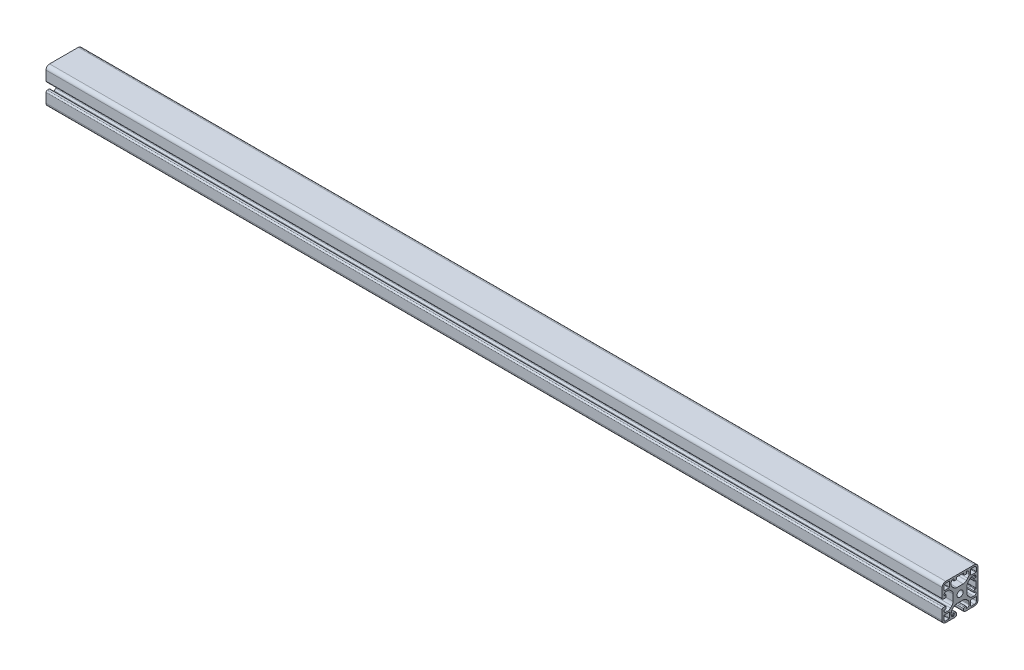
SolidWorks part; units mm, degrees
ref_plane "Ebene vorne" through (0, 0, 0) normal (0, 0, 1) x (1, 0, 0)
ref_plane "Ebene oben" through (0, 0, 0) normal (0, 1, 0) x (1, 0, 0)
ref_plane "Ebene rechts" through (0, 0, 0) normal (1, 0, 0) x (0, 0, -1)
sketch "Skizze1" plane through (0, 0, 0) normal (0, 1, 0) x (1, 0, 0)
  line L0 (0, 0) -> (1000, 0)
  dimension "D1" = 1000
other "Strukturbauteil1"
ref_plane "Ebene1" through (0, 0, 0) normal (1, 0, 0) x (0, 0, -1)
sketch "Model" plane through (0, 0, 0) normal (1, 0, 0) x (0, 0, -1)
  line L0 (-5, 15.5) -> (-6.5, 15.5)
  line L1 (-7, 16) -> (-7, 17.5)
  line L2 (-10, 15.5) -> (-10, 14.1924)
  line L3 (-8.5355, 10.6569) -> (-7.0931, 9.2145)
  line L4 (-3.5576, 7.75) -> (3.5576, 7.75)
  line L5 (7.0931, 9.2145) -> (8.5355, 10.6569)
  line L6 (10, 14.1924) -> (10, 15.5)
  line L7 (7, 17.5) -> (7, 16)
  line L8 (6.5, 15.5) -> (5, 15.5)
  line L9 (4, 16.5) -> (4, 17.5)
  line L10 (3.5, 18) -> (-3.5, 18)
  line L11 (-4, 17.5) -> (-4, 16.5)
  line L12 (11.8, 17.7) -> (11.8, 12.3)
  line L13 (12.3, 11.8) -> (17.7, 11.8)
  line L14 (18.2, 12.3) -> (18.2, 16)
  line L15 (16, 18.2) -> (12.3, 18.2)
  line L16 (-16, 18.2) -> (-12.3, 18.2)
  line L17 (-11.8, 17.7) -> (-11.8, 12.3)
  line L18 (-12.3, 11.8) -> (-17.7, 11.8)
  line L19 (-18.2, 12.3) -> (-18.2, 16)
  line L20 (-16, -18.2) -> (-12.3, -18.2)
  line L21 (-11.8, -17.7) -> (-11.8, -12.3)
  line L22 (-12.3, -11.8) -> (-17.7, -11.8)
  line L23 (-18.2, -12.3) -> (-18.2, -16)
  line L24 (12.3, -18.2) -> (16, -18.2)
  line L25 (18.2, -16) -> (18.2, -12.3)
  line L26 (17.7, -11.8) -> (12.3, -11.8)
  line L27 (11.8, -12.3) -> (11.8, -17.7)
  line L28 (15.5, 5) -> (15.5, 6.5)
  line L29 (16, 7) -> (17.5, 7)
  line L30 (15.5, 10) -> (14.1924, 10)
  line L31 (10.6569, 8.5355) -> (9.2145, 7.0931)
  line L32 (7.75, 3.5576) -> (7.75, -3.5576)
  line L33 (9.2145, -7.0931) -> (10.6569, -8.5355)
  line L34 (14.1924, -10) -> (15.5, -10)
  line L35 (17.5, -7) -> (16, -7)
  line L36 (15.5, -6.5) -> (15.5, -5)
  line L37 (16.5, -4) -> (17.5, -4)
  line L38 (18, -3.5) -> (18, 3.5)
  line L39 (17.5, 4) -> (16.5, 4)
  line L40 (-20, -5.5) -> (-20, -16)
  line L41 (-16, -20) -> (-5.5, -20)
  line L42 (-4, -18.5) -> (-4, -16.5)
  line L43 (-5, -15.5) -> (-6.5, -15.5)
  line L44 (-7, -16) -> (-7, -17.5)
  line L45 (-10, -15.5) -> (-10, -14.1924)
  line L46 (-8.5355, -10.6569) -> (-7.0931, -9.2145)
  line L47 (-3.5576, -7.75) -> (3.5576, -7.75)
  line L48 (7.0931, -9.2145) -> (8.5355, -10.6569)
  line L49 (10, -14.1924) -> (10, -15.5)
  line L50 (7, -17.5) -> (7, -16)
  line L51 (6.5, -15.5) -> (5, -15.5)
  line L52 (4, -16.5) -> (4, -18.5)
  line L53 (5.5, -20) -> (16, -20)
  line L54 (20, -16) -> (20, 16)
  line L55 (16, 20) -> (-16, 20)
  line L56 (-20, 16) -> (-20, 5.5)
  line L57 (-18.5, 4) -> (-16.5, 4)
  line L58 (-15.5, 5) -> (-15.5, 6.5)
  line L59 (-16, 7) -> (-17.5, 7)
  line L60 (-15.5, 10) -> (-14.1924, 10)
  line L61 (-10.6569, 8.5355) -> (-9.2145, 7.0931)
  line L62 (-7.75, 3.5576) -> (-7.75, -3.5576)
  line L63 (-9.2145, -7.0931) -> (-10.6569, -8.5355)
  line L64 (-14.1924, -10) -> (-15.5, -10)
  line L65 (-17.5, -7) -> (-16, -7)
  line L66 (-15.5, -6.5) -> (-15.5, -5)
  line L67 (-16.5, -4) -> (-18.5, -4)
  line L68 (-7.55, 17.9995) -> (-7.4501, 17.9975)
  line L69 (-20, 20) -> (20, 20) construction
  line L70 (-20, 20) -> (-20, -20) construction
  line L71 (-20, -20) -> (20, -20) construction
  line L72 (20, 20) -> (20, -20) construction
  line L73 (-20, 20) -> (20, -20) construction
  line L74 (-20, -20) -> (20, 20) construction
  line L75 (7.4501, 17.9975) -> (7.55, 17.9995)
  line L76 (17.9995, 7.55) -> (17.9975, 7.4501)
  line L77 (17.9975, -7.4501) -> (17.9995, -7.55)
  line L78 (7.4501, -17.9975) -> (7.55, -17.9995)
  line L79 (-7.55, -17.9995) -> (-7.4501, -17.9975)
  line L80 (-17.9975, -7.4501) -> (-17.9995, -7.55)
  line L81 (-17.9995, 7.55) -> (-17.9975, 7.4501)
  line L90 (0, -20) -> (0, 20) construction
  line L91 (-20, 0) -> (20, 0) construction
  circle A0 centre (0, 0) radius 3.4
  arc A1 (-5, 15.5) -> (-4, 16.5) centre (-5, 16.5) ccw
  arc A2 (-7, 16) -> (-6.5, 15.5) centre (-6.5, 16) ccw
  arc A3 (-17.9975, 7.4501) -> (-17.5, 7) centre (-17.5, 7.5) ccw
  arc A4 (-7.55, 17.9995) -> (-10, 15.5) centre (-7.5, 15.5) ccw
  arc A5 (-10, 14.1924) -> (-8.5355, 10.6569) centre (-5, 14.1924) ccw
  arc A6 (-7.0931, 9.2145) -> (-3.5576, 7.75) centre (-3.5576, 12.75) ccw
  arc A7 (3.5576, 7.75) -> (7.0931, 9.2145) centre (3.5576, 12.75) ccw
  arc A8 (8.5355, 10.6569) -> (10, 14.1924) centre (5, 14.1924) ccw
  arc A9 (10, 15.5) -> (7.55, 17.9995) centre (7.5, 15.5) ccw
  arc A10 (-17.5, -7) -> (-17.9975, -7.4501) centre (-17.5, -7.5) ccw
  arc A11 (6.5, 15.5) -> (7, 16) centre (6.5, 16) ccw
  arc A12 (4, 16.5) -> (5, 15.5) centre (5, 16.5) ccw
  arc A13 (4, 17.5) -> (3.5, 18) centre (3.5, 17.5) ccw
  arc A14 (-3.5, 18) -> (-4, 17.5) centre (-3.5, 17.5) ccw
  arc A15 (11.8, 12.3) -> (12.3, 11.8) centre (12.3, 12.3) ccw
  arc A16 (17.7, 11.8) -> (18.2, 12.3) centre (17.7, 12.3) ccw
  arc A17 (18.2, 16) -> (16, 18.2) centre (16, 16) ccw
  arc A18 (12.3, 18.2) -> (11.8, 17.7) centre (12.3, 17.7) ccw
  arc A19 (-11.8, 17.7) -> (-12.3, 18.2) centre (-12.3, 17.7) ccw
  arc A20 (-12.3, 11.8) -> (-11.8, 12.3) centre (-12.3, 12.3) ccw
  arc A21 (-18.2, 12.3) -> (-17.7, 11.8) centre (-17.7, 12.3) ccw
  arc A22 (-16, 18.2) -> (-18.2, 16) centre (-16, 16) ccw
  arc A23 (-18.2, -16) -> (-16, -18.2) centre (-16, -16) ccw
  arc A24 (-12.3, -18.2) -> (-11.8, -17.7) centre (-12.3, -17.7) ccw
  arc A25 (-11.8, -12.3) -> (-12.3, -11.8) centre (-12.3, -12.3) ccw
  arc A26 (-17.7, -11.8) -> (-18.2, -12.3) centre (-17.7, -12.3) ccw
  arc A27 (16, -18.2) -> (18.2, -16) centre (16, -16) ccw
  arc A28 (18.2, -12.3) -> (17.7, -11.8) centre (17.7, -12.3) ccw
  arc A29 (12.3, -11.8) -> (11.8, -12.3) centre (12.3, -12.3) ccw
  arc A30 (11.8, -17.7) -> (12.3, -18.2) centre (12.3, -17.7) ccw
  arc A31 (16, 7) -> (15.5, 6.5) centre (16, 6.5) ccw
  arc A32 (-7, -17.5) -> (-7.4501, -17.9975) centre (-7.5, -17.5) cw
  arc A33 (17.9995, 7.55) -> (15.5, 10) centre (15.5, 7.5) ccw
  arc A34 (14.1924, 10) -> (10.6569, 8.5355) centre (14.1924, 5) ccw
  arc A35 (9.2145, 7.0931) -> (7.75, 3.5576) centre (12.75, 3.5576) ccw
  arc A36 (7.75, -3.5576) -> (9.2145, -7.0931) centre (12.75, -3.5576) ccw
  arc A37 (10.6569, -8.5355) -> (14.1924, -10) centre (14.1924, -5) ccw
  arc A38 (15.5, -10) -> (17.9995, -7.55) centre (15.5, -7.5) ccw
  arc A39 (7, -17.5) -> (7.4501, -17.9975) centre (7.5, -17.5) ccw
  arc A40 (15.5, -6.5) -> (16, -7) centre (16, -6.5) ccw
  arc A41 (16.5, -4) -> (15.5, -5) centre (16.5, -5) ccw
  arc A42 (17.5, -4) -> (18, -3.5) centre (17.5, -3.5) ccw
  arc A43 (18, 3.5) -> (17.5, 4) centre (17.5, 3.5) ccw
  arc A44 (15.5, 5) -> (16.5, 4) centre (16.5, 5) ccw
  arc A45 (-20, -16) -> (-16, -20) centre (-16, -16) ccw
  arc A46 (-5.5, -20) -> (-4, -18.5) centre (-5.5, -18.5) ccw
  arc A47 (-4, -16.5) -> (-5, -15.5) centre (-5, -16.5) ccw
  arc A48 (-6.5, -15.5) -> (-7, -16) centre (-6.5, -16) ccw
  arc A49 (17.9975, -7.4501) -> (17.5, -7) centre (17.5, -7.5) ccw
  arc A50 (-10, -15.5) -> (-7.55, -17.9995) centre (-7.5, -15.5) ccw
  arc A51 (-8.5355, -10.6569) -> (-10, -14.1924) centre (-5, -14.1924) ccw
  arc A52 (-3.5576, -7.75) -> (-7.0931, -9.2145) centre (-3.5576, -12.75) ccw
  arc A53 (7.0931, -9.2145) -> (3.5576, -7.75) centre (3.5576, -12.75) ccw
  arc A54 (10, -14.1924) -> (8.5355, -10.6569) centre (5, -14.1924) ccw
  arc A55 (7.55, -17.9995) -> (10, -15.5) centre (7.5, -15.5) ccw
  arc A56 (17.5, 7) -> (17.9975, 7.4501) centre (17.5, 7.5) ccw
  arc A57 (7, -16) -> (6.5, -15.5) centre (6.5, -16) ccw
  arc A58 (5, -15.5) -> (4, -16.5) centre (5, -16.5) ccw
  arc A59 (4, -18.5) -> (5.5, -20) centre (5.5, -18.5) ccw
  arc A60 (16, -20) -> (20, -16) centre (16, -16) ccw
  arc A61 (20, 16) -> (16, 20) centre (16, 16) ccw
  arc A62 (-16, 20) -> (-20, 16) centre (-16, 16) ccw
  arc A63 (-20, 5.5) -> (-18.5, 4) centre (-18.5, 5.5) ccw
  arc A64 (-16.5, 4) -> (-15.5, 5) centre (-16.5, 5) ccw
  arc A65 (-15.5, 6.5) -> (-16, 7) centre (-16, 6.5) ccw
  arc A66 (7, 17.5) -> (7.4501, 17.9975) centre (7.5, 17.5) cw
  arc A67 (-15.5, 10) -> (-17.9995, 7.55) centre (-15.5, 7.5) ccw
  arc A68 (-10.6569, 8.5355) -> (-14.1924, 10) centre (-14.1924, 5) ccw
  arc A69 (-7.75, 3.5576) -> (-9.2145, 7.0931) centre (-12.75, 3.5576) ccw
  arc A70 (-9.2145, -7.0931) -> (-7.75, -3.5576) centre (-12.75, -3.5576) ccw
  arc A71 (-14.1924, -10) -> (-10.6569, -8.5355) centre (-14.1924, -5) ccw
  arc A72 (-17.9995, -7.55) -> (-15.5, -10) centre (-15.5, -7.5) ccw
  arc A73 (-7, 17.5) -> (-7.4501, 17.9975) centre (-7.5, 17.5) ccw
  arc A74 (-16, -7) -> (-15.5, -6.5) centre (-16, -6.5) ccw
  arc A75 (-15.5, -5) -> (-16.5, -4) centre (-16.5, -5) ccw
  arc A76 (-18.5, -4) -> (-20, -5.5) centre (-18.5, -5.5) ccw
  point P188 (0, 0)
  point P222 (-20, 0)
  point P223 (0, -20)
